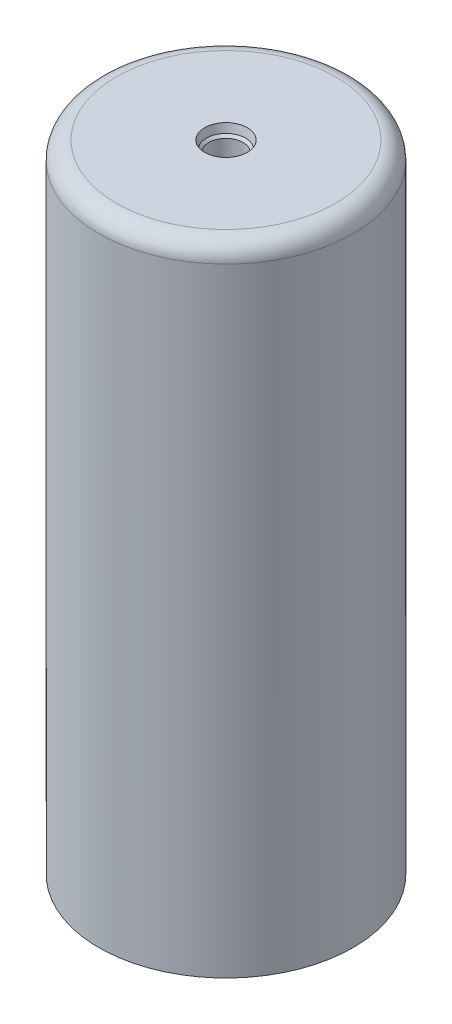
SolidWorks part; units mm, degrees
ref_plane "Front Plane" through (0, 0, 0) normal (0, 0, 1) x (1, 0, 0)
ref_plane "Top Plane" through (0, 0, 0) normal (0, 1, 0) x (1, 0, 0)
ref_plane "Right Plane" through (0, 0, 0) normal (1, 0, 0) x (0, 0, -1)
sketch "Sketch1" plane through (0, 0, 0) normal (0, 0, 1) x (1, 0, 0)
  line L0 (0, 0) -> (-1.5488, 0)
  line L1 (-31.75, 6.477) -> (-31.75, 14.097)
  line L2 (-31.496, 174.625) -> (0, 174.625)
  line L3 (0, 0) -> (-1.5488, 0)
  line L4 (0, 0) -> (0, 54.5744)
  line L5 (-36.83, 0) -> (-36.83, 184.15)
  line L6 (-36.83, 184.15) -> (0, 184.15)
  line L7 (-33.147, 0) -> (-33.147, 2.159)
  line L8 (-33.147, 5.08) -> (-31.75, 6.477)
  line L9 (0, 54.5744) -> (0, 184.15)
  line L10 (-33.147, 0) -> (-34.29, 0)
  line L11 (-34.29, 0) -> (-36.83, 0)
  line L12 (-33.147, 4.191) -> (-33.147, 5.08)
  line L13 (-33.782, 4.191) -> (-33.147, 4.191)
  line L14 (-33.782, 4.191) -> (-33.782, 2.159)
  line L15 (-33.782, 2.159) -> (-33.147, 2.159)
  line L16 (-31.75, 14.097) -> (-31.496, 14.351)
  line L17 (-31.496, 14.351) -> (-31.496, 174.625)
  dimension "D1" = 31.75
  dimension "D2" = 5.08
  dimension "D3" = 66.294
  dimension "D4" = 225
  dimension "D5" = 5.08
  dimension "D6" = 2.032
  dimension "D7" = 0.635
  dimension "D8" = 2.159
  dimension "D9" = 7.62
  dimension "D10" = 45
  dimension "D11" = 31.496
  dimension "D12" = 184.15
  dimension "D13" = 174.625
revolve "Revolve2" add sketch "Sketch1" angle 360 about L4
fillet "Fillet1" radius 5.08 2 edges at (0, 184.15, -36.83) (0, 174.625, -31.496)
chamfer "Chamfer1" distance 0.762 angle 60 1 edges at (0, 0, -33.147)
sketch "Sketch2" plane through (0, 184.15, 0) normal (0, 1, 0) x (-1, 0, 0)
  point P0 (0, 0)
sketch "Sketch4" plane through (0, 0, 0) normal (0, 0, 1) x (1, 0, 0)
  line L0 (33.147, 1.3198) -> (-33.147, 1.3198) construction
  line L1 (-4.7625, 4.7117) -> (4.765, 4.7117)
  line L2 (-6.35, 3.1242) -> (-6.35, 3.1217)
  line L3 (4.765, 1.5367) -> (-3.5034, 1.5367)
  line L4 (6.35, 3.1267) -> (6.35, 3.1217)
  line L5 (-36.83, 0) -> (36.83, 0) construction
  line L6 (-3.5034, 1.5367) -> (-4.765, 1.5367)
  arc A0 (-6.35, 3.1242) -> (-4.7625, 4.7117) centre (-4.7625, 3.1242) cw
  arc A1 (-6.35, 3.1217) -> (-4.765, 1.5367) centre (-4.765, 3.1217) ccw
  arc A2 (6.35, 3.1217) -> (4.765, 1.5367) centre (4.765, 3.1217) cw
  arc A3 (4.765, 4.7117) -> (6.35, 3.1267) centre (4.765, 3.1267) cw
  point P6 (0, 0)
  point P15 (6.35, 1.3198)
  dimension "D4" = 1.5875
  dimension "D1" = 1.585
  dimension "D2" = 3.1242
  dimension "D3" = 6.35
extrude "Cut-Extrude1" cut sketch "Sketch4" against normal up to next
sketch "Sketch5" plane through (0, 0, 0) normal (1, 0, 0) x (0, 0, -1)
  line L1 (-4.765, 4.7092) -> (4.765, 4.7092)
  line L2 (-6.35, 3.1242) -> (-6.35, 3.1191)
  line L3 (-4.765, 1.5342) -> (4.765, 1.5342)
  line L4 (6.35, 3.1242) -> (6.35, 3.1191)
  line L5 (-36.83, 0) -> (36.83, 0) construction
  arc A0 (-6.35, 3.1242) -> (-4.765, 4.7092) centre (-4.765, 3.1242) cw
  arc A1 (-4.765, 1.5342) -> (-6.35, 3.1191) centre (-4.765, 3.1191) cw
  arc A2 (6.35, 3.1191) -> (4.765, 1.5342) centre (4.765, 3.1191) cw
  arc A3 (4.765, 4.7092) -> (6.35, 3.1242) centre (4.765, 3.1242) cw
  point P11 (6.35, 1.5342)
  point P14 (6.35, 4.7092)
  dimension "D4" = 1.585
  dimension "D1" = 3.175
  dimension "D2" = 6.35
  dimension "D3" = 12.7
  dimension "D5" = 3.1242
extrude "Cut-Extrude2" cut sketch "Sketch5" against normal up to next
hole_wizard "SAE#4" positions "Sketch21" profile "Sketch3" legacy
sketch "Sketch21" plane through (64.8036, 184.15, 62.9896) normal (0, 1, 0) x (-1, 0, 0)
  point P0 (64.8036, -62.9896)
sketch "Sketch3" plane through (0, 184.15, 0) normal (1, 0, 0) x (0, 0, 1)
  line L0 (0, 0) -> (0, 13.8938)
  line L1 (0, 13.8938) -> (4.9606, 13.8938)
  line L2 (4.9606, 13.8938) -> (4.9606, 3.0844)
  line L3 (5.6828, 2.3622) -> (6.1849, 0)
  line L4 (6.1849, 0) -> (0, 0)
  line L5 (0, -6.4453) -> (0, 42.3633) construction
  line L6 (-5.5093, 3.1784) -> (-6.1849, 0) construction
  line L7 (4.9606, 3.0844) -> (5.6828, 2.3622)
  line L11 (0, 14.605) -> (0, 169.799) construction
  dimension "Diameter" = 9.9212
  dimension "Depth" = 13.8938
  dimension "C-Sink Angle" = 24
  dimension "C-Sink Diameter" = 12.3698
other "SAE#4-Port<1>"
